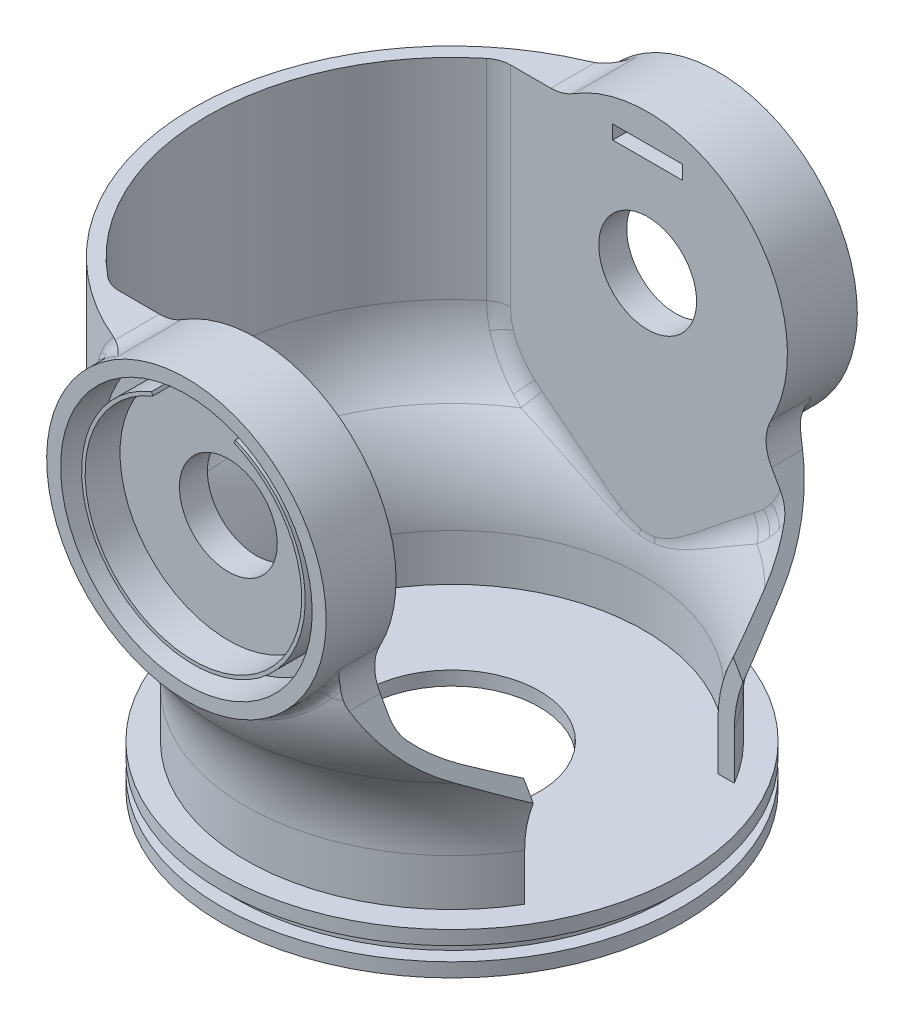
SolidWorks part; units mm, degrees
ref_plane "Front Plane" through (0, 0, 0) normal (0, 0, 1) x (1, 0, 0)
ref_plane "Top Plane" through (0, 0, 0) normal (0, 1, 0) x (1, 0, 0)
ref_plane "Right Plane" through (0, 0, 0) normal (1, 0, 0) x (0, 0, -1)
sketch "Sketch1" plane through (0, 0, 0) normal (0, 0, 1) x (1, 0, 0)
  line L0 (0, 0) -> (14.75, 0)
  line L1 (14.75, 0) -> (14.75, 4.3408)
  line L2 (18.5, 16) -> (18.5, 31)
  line L3 (0, 0) -> (0, 31) construction
  line L4 (0, 31) -> (18.5, 31)
  line L5 (0, 0) -> (0, 31)
  arc A0 (14.75, 4.3408) -> (16.625, 10.1704) centre (24.75, 4.3408) cw
  arc A1 (16.625, 10.1704) -> (18.5, 16) centre (8.5, 16) ccw
  dimension "D4" = 10
  dimension "D1" = 29.5
  dimension "D2" = 37
  dimension "D3" = 31
  dimension "D5" = 15
revolve "Revolve1" add sketch "Sketch1" angle 180 about L3
sketch "Sketch5" plane through (0, 0, 0) normal (0, 0, 1) x (1, 0, 0)
  line L0 (14.7718, 5) -> (0, 31)
  line L2 (18.5, 31) -> (-18.5, 31) construction
  line L4 (-14.75, 0) -> (14.75, 0) construction
  arc A1 (16.625, 10.1704) -> (14.75, 4.3408) centre (24.75, 4.3408) ccw construction
  dimension "D1" = 5
extrude "Cut-Extrude1" cut sketch "Sketch5" against normal through all and the other way through all flip side to cut
shell "Shell3" thickness 1
ref_plane "Plane3" through (0, 0, 14) normal (0, 0, 1) x (1, 0, 0)
sketch "Sketch12" plane through (0, 0, 14) normal (0, 0, 1) x (1, 0, 0)
  line L0 (50, 0) -> (-50, 0) construction
  line L1 (0, -19.25) -> (0, 19.25) construction
  circle A0 centre (0, 23) radius 10
  dimension "D1" = 20
  dimension "D2" = 33
extrude "Extrude3" add sketch "Sketch12" along normal blind 5
sketch "Sketch13" plane through (0, 0, 14) normal (0, 0, 1) x (1, 0, 0)
  line L0 (-10.5, 16) -> (-10.5, 31)
  line L1 (-10.5, 16) -> (-10.5, 31)
  line L2 (11.503, 10.7533) -> (8.5222, 16) construction
  line L3 (8.5222, 16) -> (7.9738, 16.9652) construction
  line L4 (9.919, 13.5414) -> (8.5222, 16)
  line L5 (8.5222, 16) -> (0, 31)
  line L6 (-6, 31) -> (-17.5, 31) construction
  line L7 (0, 31) -> (-10.5, 31)
  point P4 (7.3509, 10.7533)
  point P5 (-7.3509, 10.7533)
extrude "Extrude5" add sketch "Sketch13" along normal up to body separate body
sketch "Sketch11" plane through (0, 1, 0) normal (0, 1, 0) x (-1, 0, 0)
  circle A0 centre (0, 0) radius 6.25
  dimension "D1" = 12.5
extrude "Cut-Extrude3" cut sketch "Sketch11" against normal through all
fillet "Fillet4" radius 2 13 edges
fillet "Fillet9" radius 3 1 edges at (-6, 31, 15.75)
fillet "Fillet11" radius 3 4 edges at (8.2491, 16.4806, 16.5591) (7.9738, 16.9652, 15.3467) (8.5222, 16, 14.6424) (8.248, 16.4826, 14)
fillet "Fillet12" radius 1 3 edges at (-9.7817, 25.078, 15.7025) (-1.6049, 13.1296, 18.0078)
sketch "Sketch16" plane through (0, 0, 0) normal (0, 0, -1) x (-1, 0, 0)
  line L0 (-16.5, -1) -> (-16.5, -2)
  line L1 (-14.75, 1) -> (-16.5, 1)
  line L2 (-14.75, 1) -> (-14.75, -2)
  line L3 (-14.75, -2) -> (-16.5, -2)
  line L4 (-16.5, 1) -> (-16.5, 0)
  line L5 (-16.5, 0) -> (-15.5, 0)
  line L6 (0, 0) -> (0, 6.5274) construction
  line L7 (-16.5, -1) -> (-15.5, -1)
  line L8 (-15.5, 0) -> (-15.5, -1)
  line L10 (-14.75, 0) -> (-14.75, 4.3408) construction
  line L11 (-14.75, 0) -> (-6.25, 0) construction
  dimension "D1" = 33
  dimension "D2" = 3
  dimension "D3" = 1
revolve "Revolve2" add sketch "Sketch16" angle 180 about L6
sketch "Sketch18" plane through (0, 0, 19) normal (0, 0, 1) x (1, 0, 0)
  circle A2 centre (0, 23) radius 9
  circle A3 centre (0, 23) radius 9
  dimension "D1" = 1
extrude "Cut-Extrude5" cut sketch "Sketch18" against normal blind 3
sketch "Sketch19" plane through (0, 0, 16) normal (0, 0, 1) x (1, 0, 0)
  line L0 (0, 23) -> (0, 30) construction
  line L1 (-2.5, 31) -> (2.5, 31)
  line L2 (-2.5, 31) -> (-2.5, 30)
  line L3 (-2.5, 30) -> (2.5, 30)
  line L4 (2.5, 31) -> (2.5, 30)
  circle A2 centre (0, 23) radius 10 construction
  dimension "D1" = 1
  dimension "D2" = 5
  dimension "D3" = 2
extrude "Cut-Extrude6" cut sketch "Sketch19" against normal through all
sketch "Sketch20" plane through (0, 0, 16) normal (0, 0, 1) x (1, 0, 0)
  line L0 (2.5, 30) -> (2.5, 31) construction
  line L1 (-2.5, 31) -> (-2.5, 30) construction
  arc A0 (3, 30.4162) -> (-3, 30.4162) centre (0, 23) cw
  dimension "D3" = 8
  dimension "D1" = 0.5
  dimension "D2" = 0.5
extrude "Extrude-Thin1" add sketch "Sketch20" along normal offset from surface (2.5 mm away) 0.5 thin
hole_wizard "M7.0 (7) Diameter Hole1" positions "Sketch22" profile "Sketch21" hole size "M7.0" standard "Ansi Metric"
sketch "Sketch22" plane through (0, 0, 16) normal (0, 0, 1) x (1, 0, 0)
  point P0 (0, 23)
sketch "Sketch21" plane through (0, 23, 16) normal (1, 0, 0) x (0, -1, 0)
  line L0 (0, 0) -> (0, 16)
  line L1 (0, 16) -> (3.5, 16)
  line L2 (3.5, 16) -> (3.5, 0)
  line L5 (3.5, 0) -> (0, 0)
  line L11 (0, -6.35) -> (0, 107.95) construction
  dimension "Thru Hole Dia." = 7
  dimension "Thru Hole Depth" = 16
sketch "Sketch6" plane through (0, 1, 0) normal (0, 1, 0) x (-1, 0, 0)
  line L0 (0, 0) -> (-14.7718, 0) construction
  line L1 (-14.7718, 7.5) -> (-14.7718, -7.5)
  line L2 (-14.7718, -7.5) -> (0, -7.5)
  line L3 (-14.7718, 7.5) -> (0, 7.5)
  line L4 (0, -7.5) -> (0, 7.5)
  spline S0 degree 3 poles (-11.8342, 11.6765) (-12.1539, 10.7778) (-12.481, 9.8888) (-13.1202, 8.0912) (-13.4328, 7.1834) (-13.8611, 5.769) (-13.997, 5.2887) (-14.1847, 4.5473) (-14.2446, 4.2966) (-14.3576, 3.7867) (-14.411, 3.5262) (-14.6538, 2.214) (-14.7718, 1.1319) (-14.7718, 0) knots 0 0 0 0 0.25 0.25 0.5 0.5 0.625 0.625 0.6875 0.6875 0.75 0.75 1 1 1 1 construction
  dimension "D1" = 15
extrude "Cut-Extrude2" cut sketch "Sketch6" along normal through all
mirror "Mirror2"
sketch "Sketch17" plane through (0, 1, 0) normal (0, 1, 0) x (-1, 0, 0)
  line L0 (0, 0) -> (0, 6.75) construction
  line L1 (-3, 6.75) -> (-3, 5.4829)
  line L2 (-3, 6.75) -> (3, 6.75)
  line L3 (3, 6.75) -> (3, 5.4829)
  circle A0 centre (0, 0) radius 6.25 construction
  dimension "D1" = 6
  dimension "D2" = 13
extrude "Cut-Extrude4" cut sketch "Sketch17" against normal through all and the other way through all flip side to cut
